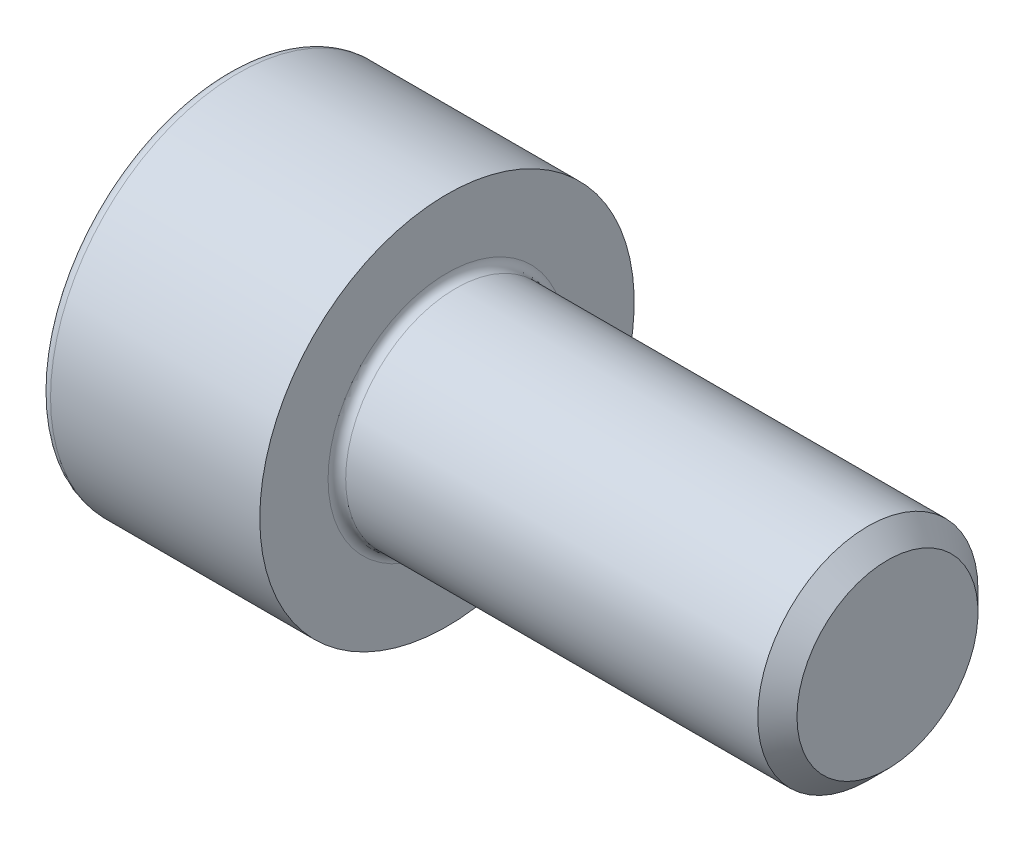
SolidWorks part; units mm, degrees
ref_plane "Plane1" through (0, 0, 0) normal (0, 0, 1) x (1, 0, 0)
ref_plane "Plane2" through (0, 0, 0) normal (0, 1, 0) x (1, 0, 0)
ref_plane "Plane3" through (0, 0, 0) normal (1, 0, 0) x (0, 0, -1)
revolve "Base-Revolve" add sketch "BodySke"
sketch "BodySke" plane through (0, 0, 0) normal (0, 0, 1) x (1, 0, 0)
  line L0 (0, 0) -> (0, 4.25)
  line L1 (0, 4.25) -> (5, 4.25)
  line L2 (5, 4.25) -> (5, 2.5)
  line L3 (5, 2.5) -> (14.555, 2.5)
  line L4 (15, 2.055) -> (15, 0)
  line L5 (15, 0) -> (0, 0)
  line L6 (-31.75, 0) -> (127, 0) construction
  line L8 (15, 2.055) -> (14.555, 2.5)
  line L10 (15, -2.055) -> (14.555, -2.5) construction
  line L11 (5.8, 9.525) -> (5.8, 3.175) construction
  line L12 (5, 9.525) -> (5, 3.175) construction
  line L13 (-45, 9.525) -> (-45, 3.175) construction
  dimension "Diameter" = 5
  dimension "Head_ht" = 5
  dimension "Length" = 10
  dimension "Body_ch_ang" = 45
  dimension "Head_dia" = 8.5
  dimension "Minor_dia" = 4.11
  dimension "Advance" = 0.8
  dimension "Thread_nom" = 10
  dimension "Thread_length" = 60
fillet "Fillet1" radius 0.2 1 edges at (5, 0, 2.5)
fillet "Fillet2" radius 0.25 1 edges at (0, 0, 4.25)
sketch "Sketch2" plane through (0, 0, 0) normal (0, 0, 1) x (1, 0, 0)
  line L0 (0, 2.042) -> (2.5, 2.042)
  line L1 (2.5, 2.042) -> (3.6789, 0)
  line L2 (-31.75, 0) -> (127, 0) construction
  line L3 (3.6789, 0) -> (0, 0)
  line L4 (0, 0) -> (0, 2.042)
  line L6 (0, 0) -> (47.625, 0) construction
  dimension "D1" = 2.042
  dimension "D2" = 60
  dimension "Depth" = 2.5
revolve "Hex-PreBroach" cut sketch "Sketch2" angle 360 about L6
sketch "Sketch3" plane through (0, 0, 0) normal (-1, 0, 0) x (0, 0.5, 0.866)
  line L0 (1.1789, 2.042) -> (-1.1789, 2.042)
  line L1 (-1.1789, 2.042) -> (-2.3579, 0)
  line L2 (1.1789, 2.042) -> (2.3579, 0)
  line L3 (1.1789, -2.042) -> (2.3579, 0)
  line L4 (1.1789, -2.042) -> (-1.1789, -2.042)
  line L5 (-1.1789, -2.042) -> (-2.3579, 0)
  dimension "D1" = 2.042
  dimension "D2" = 2.042
  dimension "Hex_size" = 4.084
extrude "Hex" cut sketch "Sketch3" against normal blind 2.5
sketch "ThdSchSke" plane through (0, 0, 0) normal (0, 0, 1) x (1, 0, 0)
  line L0 (7.4, -2.055) -> (7.0884, -2.5)
  line L1 (7.4, -2.055) -> (7.7116, -2.5)
  line L2 (7.7116, -2.5) -> (7.7116, -3.125)
  line L3 (-3.175, 0) -> (5.1513, 0) construction
  line L4 (0, 4) -> (0, -4) construction
  line L5 (7.7116, -3.125) -> (7.0884, -3.125)
  line L6 (7.0884, -3.125) -> (7.0884, -2.5)
  dimension "Thread_minor" = 4.11
  dimension "Diameter" = 5
  dimension "Start" = 7.4
  dimension "SideAngle" = 55
  dimension "VeeAngle" = 70
  dimension "Overcut" = 6.25
revolve "ThreadSchematic" [suppressed] cut sketch "ThdSchSke" angle 360 about L3
pattern_linear "ThdSchPat" [suppressed]
equation "\"D2@Sketch3\" = \"Hex_size@Sketch3\" / 2"
equation "\"D1@Sketch3\" = \"Hex_size@Sketch3\" / 2"
equation "\"D1@Sketch2\" = \"Hex_size@Sketch3\" / 2"
equation "\"Thread_minor@ThreadCosmetic\"  =  \"Minor_dia@BodySke\""
equation "\"Depth@Sketch2\" =  \"Key_eng@Hex\""
equation "\"Thread_length@ThreadCosmetic\" = ((sgn( (\"Length@BodySke\" - \"Advance@BodySke\" * 3.0) - \"Thread_nom@BodySke\" )-1)*( (\"Length@BodySke\" - \"Advance@BodySke\" * 3.0) - \"Thread_nom@BodySke\" ))/-2+ \"Thread_no"
equation "\"Thread_minor@ThdSchSke\" = \"Minor_dia@BodySke\""
equation "\"Diameter@ThdSchSke\" = \"Diameter@BodySke\""
equation "\"Overcut@ThdSchSke\" = \"Diameter@BodySke\" * 1.25"
equation "\"Start@ThdSchSke\" = \"Head_ht@BodySke\" + \"Length@BodySke\" - \"Thread_length@ThreadCosmetic\"  '---Non-countersunk---"
equation "\"Num_threads@ThdSchPat\" = int( \"Thread_length@ThreadCosmetic\" / \"Advance@BodySke\" + 0.999 )  + 1"
equation "\"Advance@ThdSchPat\" = \"Thread_length@ThreadCosmetic\" /  (\"Num_threads@ThdSchPat\" - 1) 'relax it"
equation "\"Num_threads@ThdSchPat\" = \"Num_threads@ThdSchPat\" - sgn( \"Num_threads@ThdSchPat\" - 1) '---chamfered tips only---"
